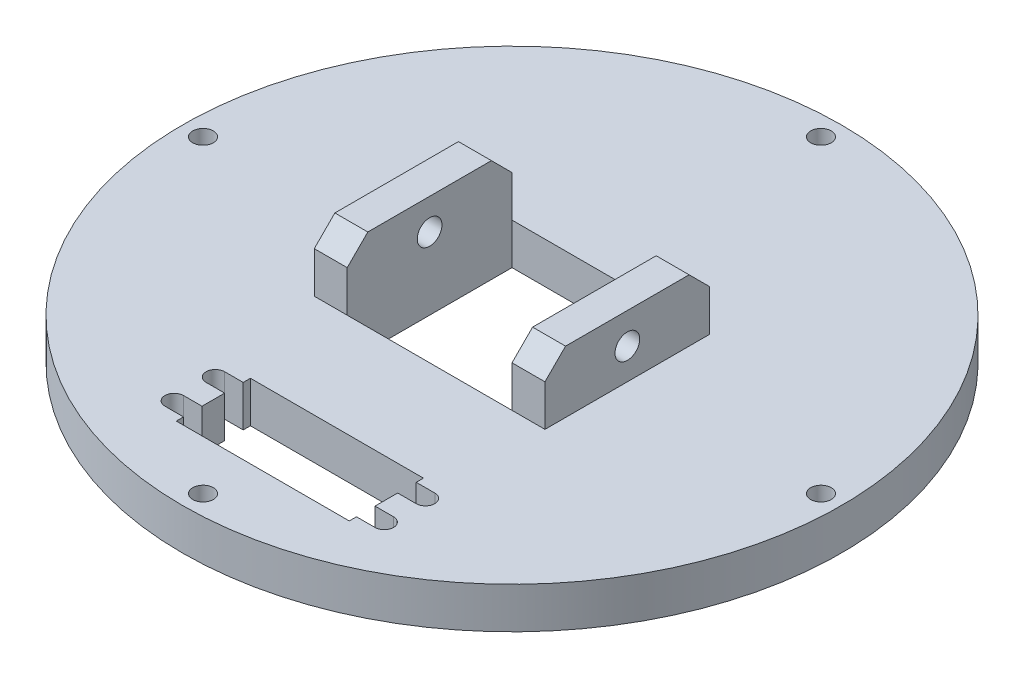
SolidWorks part; units mm, degrees
ref_plane "Front Plane" through (0, 0, 0) normal (0, 0, 1) x (1, 0, 0)
ref_plane "Top Plane" through (0, 0, 0) normal (0, 1, 0) x (1, 0, 0)
ref_plane "Right Plane" through (0, 0, 0) normal (1, 0, 0) x (0, 0, -1)
sketch "Sketch1" plane through (0, 0, 0) normal (0, 1, 0) x (1, 0, 0)
  circle A0 centre (0, 0) radius 80
  point P0 (0, 0)
  dimension "D1" = 160
extrude "Boss-Extrude1" add sketch "Sketch1" along normal blind 10 contours A0
sketch "Sketch2" plane through (0, 10, 0) normal (0, 1, 0) x (1, 0, 0)
  circle A0 centre (0, 0) radius 75 construction
  circle A1 centre (-75, 0) radius 2.5
  circle A2 centre (0, 75) radius 2.5
  circle A3 centre (75, 0) radius 2.5
  circle A4 centre (0, -75) radius 2.5
  point P3 (0, 75)
  point P4 (75, 0)
  point P5 (0, -75)
  point P6 (-75, 0)
  point P7 (-75, 0)
  point P12 (0, 75)
  point P15 (75, 0)
  point P18 (1.0208, -74.9931)
  point P19 (0, -75)
  dimension "D1" = 150
extrude "Cut-Extrude1" cut sketch "Sketch2" against normal up to next
sketch "Sketch3" plane through (0, 10, 0) normal (0, 1, 0) x (1, 0, 0)
  line L1 (-20, 20) -> (20, 20)
  line L2 (-20, 20) -> (-20, -20)
  line L3 (-20, -20) -> (20, -20)
  line L4 (20, 20) -> (20, -20)
  dimension "D1" = 40
  dimension "D2" = 20
  dimension "D3" = 20
extrude "Cut-Extrude2" cut sketch "Sketch3" against normal up to next
sketch "Sketch4" plane through (0, 10, 0) normal (0, 1, 0) x (1, 0, 0)
  line L0 (20, -20) -> (20, 20) construction
  line L1 (-18.5, -45) -> (23.5, -45)
  line L2 (-18.5, -45) -> (-18.5, -63)
  line L3 (-18.5, -63) -> (23.5, -63)
  line L4 (23.5, -45) -> (23.5, -63)
  line L5 (-20, -20) -> (20, -20) construction
  line L6 (-23, -59) -> (-18.5, -59) construction
  line L7 (-23, -49) -> (-23, -59)
  line L8 (-23, -49) -> (-18.5, -49) construction
  line L9 (-23, -46.75) -> (-18.5, -46.75)
  line L10 (-23, -51.25) -> (-18.5, -51.25)
  line L11 (28, -49) -> (28, -59)
  line L12 (-23, -56.75) -> (-18.5, -56.75)
  line L13 (-23, -61.25) -> (-18.5, -61.25)
  line L14 (23.5, -59) -> (28, -59) construction
  line L15 (23.5, -56.75) -> (28, -56.75)
  line L16 (23.5, -61.25) -> (28, -61.25)
  line L17 (23.5, -49) -> (28, -49) construction
  line L18 (23.5, -46.75) -> (28, -46.75)
  line L19 (23.5, -51.25) -> (28, -51.25)
  arc A2 (-23, -46.75) -> (-23, -51.25) centre (-23, -49) ccw
  arc A3 (-18.5, -51.25) -> (-18.5, -46.75) centre (-18.5, -49) ccw
  arc A4 (-23, -56.75) -> (-23, -61.25) centre (-23, -59) ccw
  arc A5 (-18.5, -61.25) -> (-18.5, -56.75) centre (-18.5, -59) ccw
  arc A6 (23.5, -56.75) -> (23.5, -61.25) centre (23.5, -59) ccw
  arc A7 (28, -61.25) -> (28, -56.75) centre (28, -59) ccw
  arc A8 (23.5, -46.75) -> (23.5, -51.25) centre (23.5, -49) ccw
  arc A9 (28, -51.25) -> (28, -46.75) centre (28, -49) ccw
  point P9 (-20.75, -59)
  point P12 (-20.75, -49)
  point P24 (25.75, -59)
  point P30 (25.75, -49)
  dimension "D5" = 4.5
  dimension "D8" = 4.5
  dimension "D10" = 2.25
  dimension "D9" = 2.25
  dimension "D11" = 2.25
  dimension "D12" = 2.25
  dimension "D1" = 42
  dimension "D2" = 18
  dimension "D3" = 3.5
  dimension "D4" = 25
  dimension "D6" = 10
  dimension "D7" = 4
extrude "Cut-Extrude3" cut sketch "Sketch4" against normal up to next
sketch "Sketch5" plane through (0, 10, 0) normal (0, 1, 0) x (1, 0, 0)
  line L0 (-20, -20) -> (20, -20) construction
  line L1 (-20, 20) -> (-28, 20)
  line L2 (-20, 20) -> (-20, -20)
  line L3 (-20, -20) -> (-28, -20)
  line L4 (-28, 20) -> (-28, -20)
  dimension "D1" = 8
extrude "Boss-Extrude2" add sketch "Sketch5" along normal blind 15
fillet "Fillet1" radius 5 2 edges at (-24, 25, -20) (-24, 25, 20)
sketch "Sketch6" plane through (-28, 0, 0) normal (-1, 0, 0) x (0, 0, 1)
  line L0 (-15, 25) -> (15, 25) construction
  line L2 (20, 20) -> (20, 10) construction
  circle A0 centre (0, 17.5) radius 3
  point P2 (0, 0)
  point P5 (0, 0)
  dimension "D1" = 6
  dimension "D2" = 7.5
  dimension "D3" = 20
extrude "Cut-Extrude4" cut sketch "Sketch6" against normal up to next
ref_plane "Plane1" [suppressed] through (0, 0, 0) normal (-1, 0, 0) x (0, 0, 1)
mirror "Mirror1" about plane through (0, 0, 0) normal (-1, 0, 0) of "Cut-Extrude4", "Fillet1", "Boss-Extrude2"
